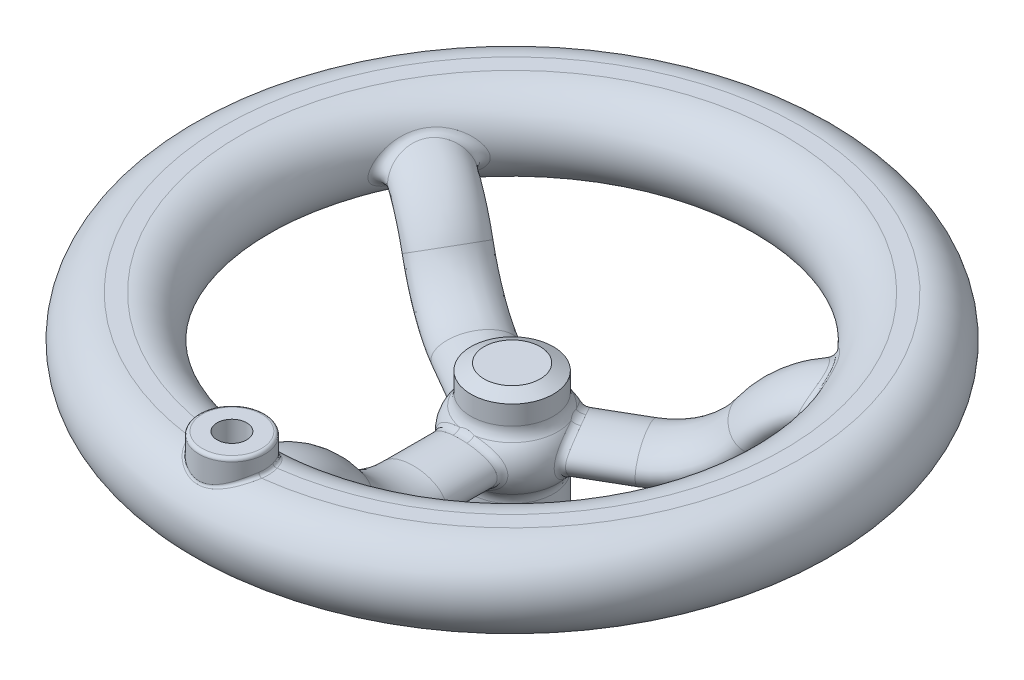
SolidWorks part; units mm, degrees
ref_plane "Front Plane" through (0, 0, 0) normal (0, 0, 1) x (1, 0, 0)
ref_plane "Top Plane" through (0, 0, 0) normal (0, 1, 0) x (1, 0, 0)
ref_plane "Right Plane" through (0, 0, 0) normal (1, 0, 0) x (0, 0, -1)
sketch "Sketch1" plane through (0, 0, 0) normal (1, 0, 0) x (0, 0, -1)
  line L0 (-12.5, 37.198) -> (-12.5, 45)
  line L1 (0, 0) -> (-12.5, 0)
  line L2 (0, 0) -> (0, 45) construction
  line L3 (0, 45) -> (-12.5, 45)
  line L4 (-12.5, 0) -> (-12.5, 16.802)
  line L5 (0, 0) -> (0, 45)
  arc A0 (-13.8333, 33.7987) -> (-13.8333, 20.2013) centre (-6.5, 27) ccw
  arc A1 (-13.8333, 20.2013) -> (-12.5, 16.802) centre (-17.5, 16.802) cw
  arc A2 (-13.8333, 33.7987) -> (-12.5, 37.198) centre (-17.5, 37.198) ccw
  point P10 (-12.5, 19)
  point P13 (-12.5, 35)
  dimension "D6" = 5
  dimension "D1" = 10
  dimension "D2" = 16
  dimension "D3" = 45
  dimension "D4" = 25
  dimension "D5" = 4
revolve "Hub" add sketch "Sketch1" angle 360 about L2
sketch "Sketch2" plane through (0, 0, 0) normal (1, 0, 0) x (0, 0, -1)
  line L0 (-87.5, 51) -> (-82.5, 51) construction
  line L1 (-87.5, 38.5) -> (-82.5, 38.5)
  line L2 (-87.5, 63.5) -> (-82.5, 63.5)
  line L3 (0, 0) -> (0, 89.3139) construction
  line L4 (12.5, 45) -> (-12.5, 45) construction
  arc A0 (-87.5, 38.5) -> (-87.5, 63.5) centre (-87.5, 51) cw
  arc A1 (-82.5, 38.5) -> (-82.5, 63.5) centre (-82.5, 51) ccw
  point P9 (-85, 51)
  dimension "D2" = 30
  dimension "D1" = 25
  dimension "D3" = 170
  dimension "D4" = 6
revolve "Rim" add sketch "Sketch2" angle 360 about L3
sketch "Sketch3" plane through (0, 0, 0) normal (1, 0, 0) x (0, 0, -1)
  line L0 (0, 27) -> (-30, 27)
  line L1 (0, 0) -> (0, 45) construction
  line L2 (-76.9894, 51) -> (-85, 51)
  arc A0 (-30, 27) -> (-53.4947, 39) centre (-30, 56) cw
  arc A1 (-53.4947, 39) -> (-76.9894, 51) centre (-76.9894, 22) ccw
  dimension "D1" = 29
  dimension "D2" = 55
sketch "Sketch4" plane through (0, 0, 0) normal (0, 0, 1) x (1, 0, 0)
  ellipse E0 centre (0, 27) end of major axis (10, 27) minor radius 6
  dimension "D1" = 20
  dimension "D2" = 12
sweep "Spoke" add profiles "Sketch4" path "Sketch3"
pattern_circular "CirPattern1" count 3 over 360 about axis through (0, 0, 0) along (0, 1, 0) of "Spoke"
fillet "Fillet1" radius 3 6 edges at (-6.369, 26.835, -15.2198) (-9.9962, 26.835, 13.1256) (16.3652, 26.835, 2.0942) (-9.9376, 50.6545, 69.2958) (65.0898, 49.0419, -26.1716) (-55.2101, 49.0419, -43.2836)
chamfer "Chamfer1" distance 4 distance2 2 1 edges at (0, 45, -12.5)
sketch "Sketch5" plane through (0, 63.5, 0) normal (0, 1, 0) x (-1, 0, 0)
  line L0 (0, 76.9894) -> (0, 85) construction
  circle A0 centre (0, 85) radius 10
  dimension "D1" = 20
extrude "Extrude1" add sketch "Sketch5" along normal blind 6 and the other way up to next
sketch "Sketch6" plane through (0, 69.5, 0) normal (0, 1, 0) x (-1, 0, 0)
  circle A0 centre (0, 85) radius 4.5
  dimension "D1" = 9
extrude "Cut-Extrude1" cut sketch "Sketch6" against normal through all
fillet "Fillet2" radius 1 5 edges at (-1.8844, 61.1183, 94.8208) (9.9838, 63.5, 84.4304) (-9.9838, 63.5, 84.4304) (1.3626, 61.0784, 75.0933) (0, 69.5, 95)
sketch "Sketch7" plane through (0, 0, 0) normal (0, -1, 0) x (1, 0, 0)
  line L0 (5.1616, 3.6987) -> (5.1616, -3.6987)
  arc A0 (5.1616, 3.6987) -> (5.1616, -3.6987) centre (0, 0) ccw
  dimension "D1" = 12.7
  dimension "D2" = 7.3975
extrude "D-Hole" cut sketch "Sketch7" against normal blind 12.7
